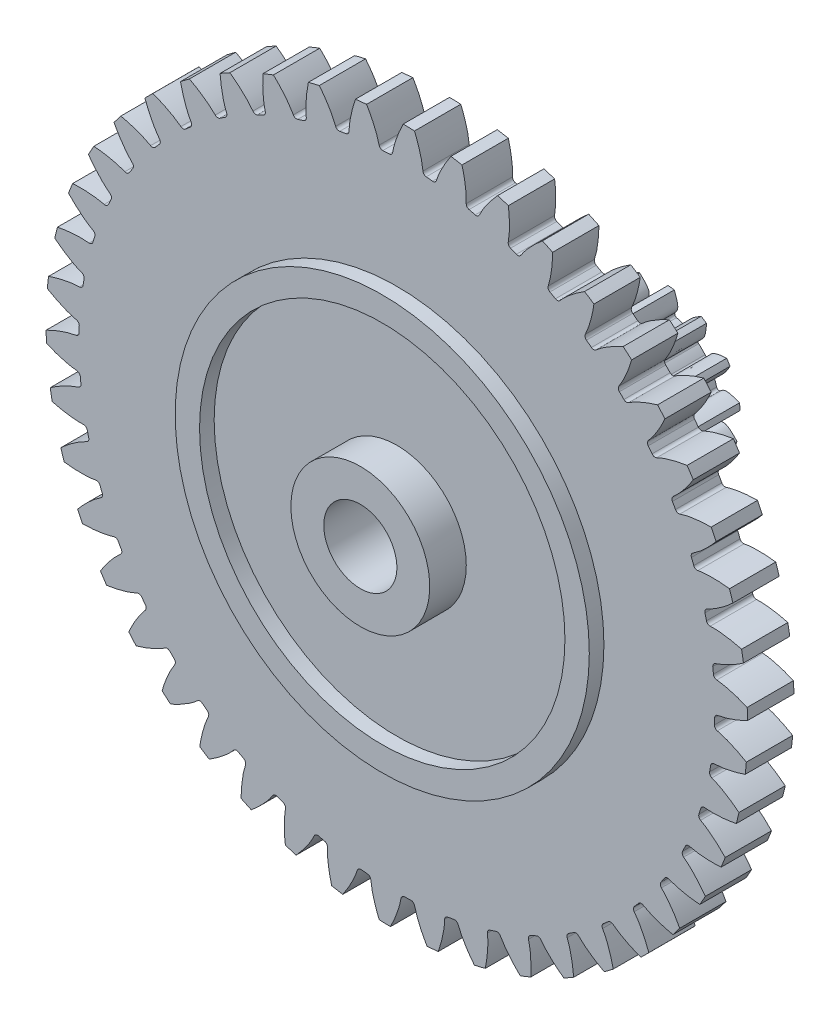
SolidWorks part; units mm, degrees
ref_plane "Face" through (0, 0, 0) normal (0, 0, 1) x (1, 0, 0)
ref_plane "Dessus" through (0, 0, 0) normal (0, 1, 0) x (1, 0, 0)
ref_plane "Droite" through (0, 0, 0) normal (1, 0, 0) x (0, 0, -1)
other "Joindre1"
other "Roue Z2 m=0,3 Z=46<1>@Z2-Z3"
other "Roue Z3 droite m=0,2 Z=14<1>@Z2-Z3"
sketch "Dp" plane through (0, 0, 0) normal (0, 0, 1) x (1, 0, 0)
  circle A0 centre (0, 0) radius 6.9 construction
  circle A1 centre (0, 0) radius 1.5 construction
  dimension "D1" = 13.8
  dimension "D2" = 3
